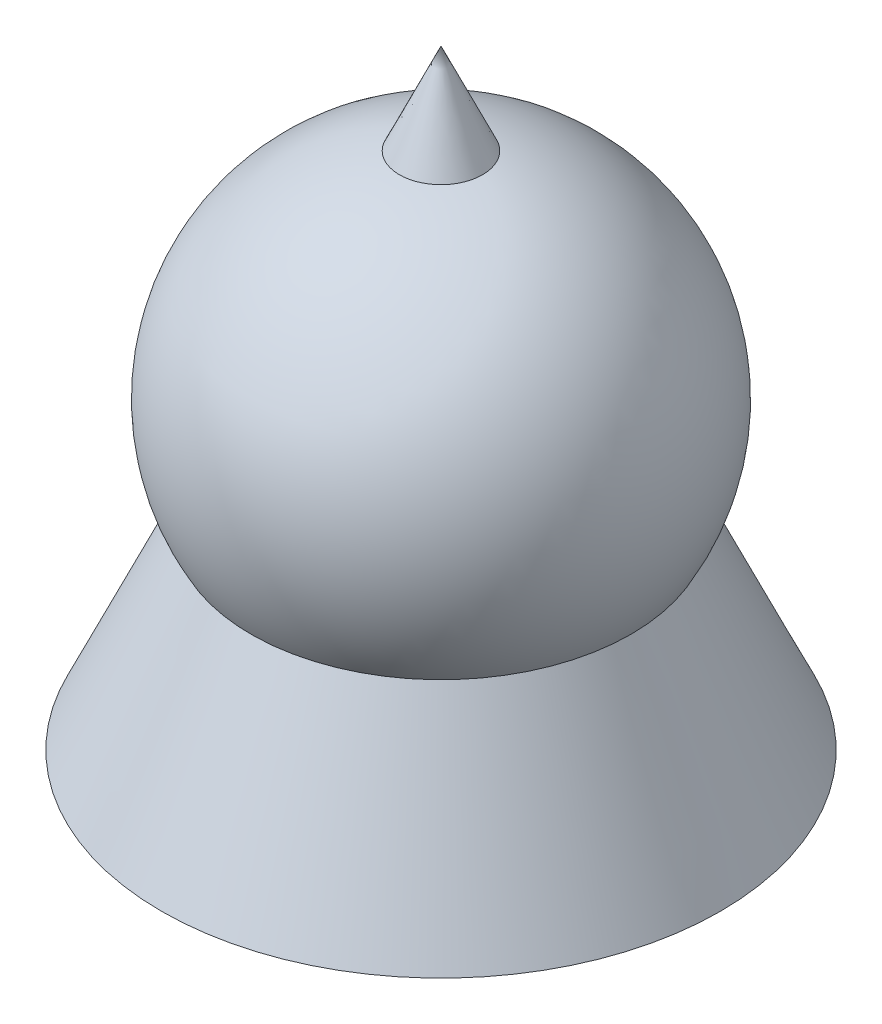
SolidWorks part; units mm, degrees
ref_plane "前视基准面" through (0, 0, 0) normal (0, 0, 1) x (1, 0, 0)
ref_plane "上视基准面" through (0, 0, 0) normal (0, 1, 0) x (1, 0, 0)
ref_plane "右视基准面" through (0, 0, 0) normal (1, 0, 0) x (0, 0, -1)
sketch "草图1" plane through (0, 0, 0) normal (0, 0, 1) x (1, 0, 0)
  line L0 (0, 82.1765) -> (0, -75.0794) construction
  line L1 (0, 44.7358) -> (-25, -9.8078)
  line L2 (-25, -9.8078) -> (0, -9.8078)
  line L3 (0, 44.7358) -> (0, -9.8078)
  dimension "D1" = 60
  dimension "D2" = 25
revolve "旋转1" add sketch "草图1" angle 360 about L0
sketch "草图2" plane through (0, 0, 0) normal (0, 0, 1) x (1, 0, 0)
  line L0 (0, 58.8341) -> (0, -24.057) construction
  line L1 (0, -2.1992) -> (0, 36.9762)
  arc A0 (0, 36.9762) -> (0, -2.1992) centre (0, 17.3885) ccw
revolve "旋转2" add sketch "草图2" angle 360 about L0
